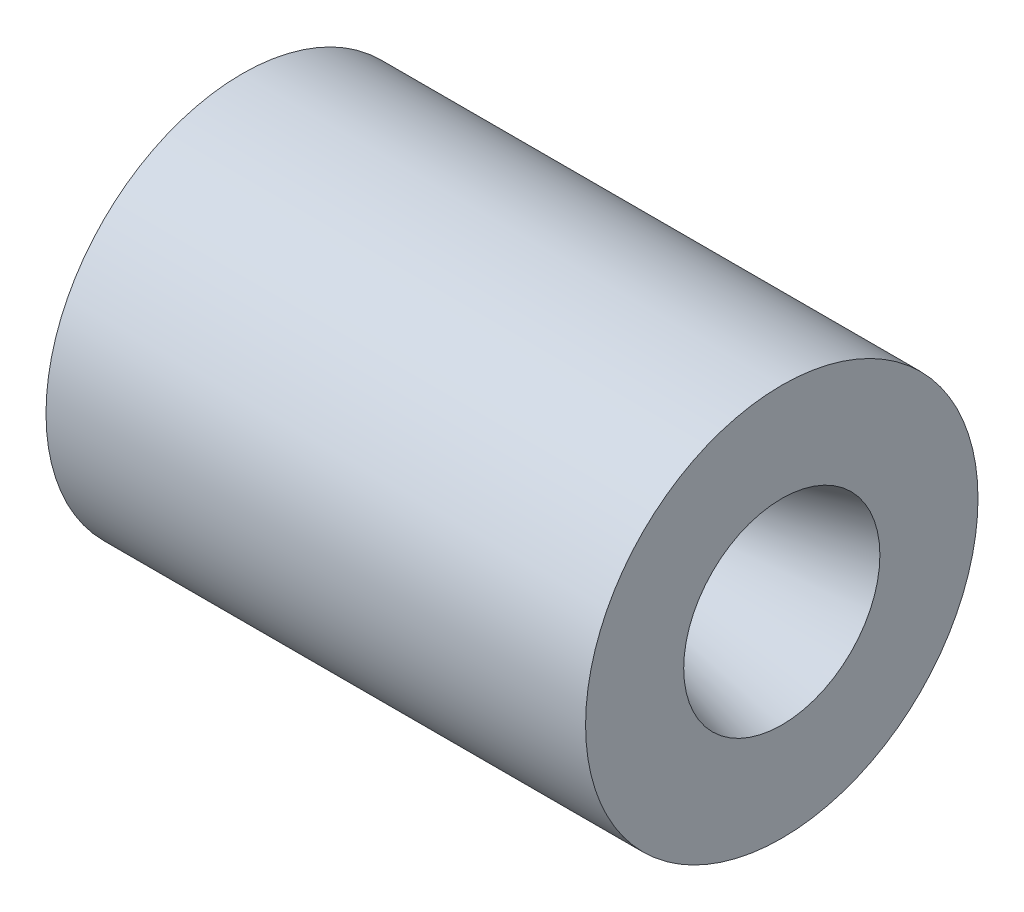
SolidWorks part; units mm, degrees
ref_plane "Front Plane" through (0, 0, 0) normal (0, 0, 1) x (1, 0, 0)
ref_plane "Top Plane" through (0, 0, 0) normal (0, 1, 0) x (1, 0, 0)
ref_plane "Right Plane" through (0, 0, 0) normal (1, 0, 0) x (0, 0, -1)
sketch "Sketch1" plane through (0, 0, 0) normal (0, 0, 1) x (1, 0, 0)
  line L0 (-1.264, 2) -> (4.236, 2)
  line L1 (4.236, 2) -> (4.236, 1)
  line L2 (4.236, 1) -> (0.8772, 0.1)
  line L3 (0.8772, 0.1) -> (0.6772, 0.1)
  line L4 (0.6772, 0.1) -> (-0.0138, 1.2499)
  line L5 (-1.264, 2) -> (-1.264, 1.2499)
  line L6 (-0.5309, 0) -> (3.699, 0) construction
  line L7 (-1.264, 1.2499) -> (-0.0138, 1.2499)
  dimension "D1" = 1.25
  dimension "D2" = 0.1
  dimension "D3" = 1
  dimension "D4" = 15
  dimension "D5" = 59
  dimension "D6" = 2
  dimension "D7" = 5.5
  dimension "D8" = 0.2
revolve "Revolve1" add sketch "Sketch1" angle 360 about L6
